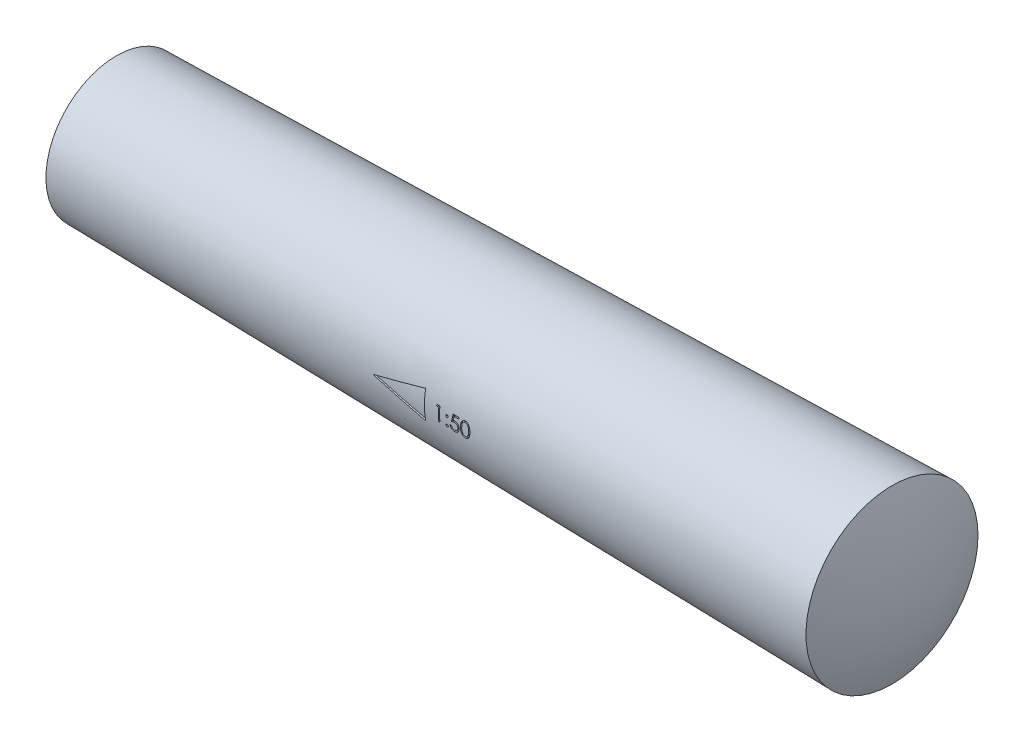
SolidWorks part; units mm, degrees
ref_plane "Front Plane" through (0, 0, 0) normal (0, 0, 1) x (1, 0, 0)
ref_plane "Top Plane" through (0, 0, 0) normal (0, 1, 0) x (1, 0, 0)
ref_plane "Right Plane" through (0, 0, 0) normal (1, 0, 0) x (0, 0, -1)
sketch "Sketch1" plane through (0, 0, 0) normal (1, 0, 0) x (0, 0, -1)
  circle A0 centre (0, 0) radius 5
  dimension "D1" = 10
extrude "Extrude1" add sketch "Sketch1" along normal mid plane 55
draft "Draft1" type of draft neutral plane draft angle 1.146 faces to draft 1 parameters "D1"=1.146
sketch "Sketch2" plane through (0, 0, 0) normal (0, 0, 1) x (1, 0, 0)
  line L0 (-27.5, 0) -> (-27.5, 5)
  line L1 (-27.5, 5) -> (-27.5, -5) construction
  line L2 (-27.5, 0) -> (-28.7, 0)
  line L3 (-28.7, 0) -> (-28.7, -5.55) construction
  line L4 (27.5, 0) -> (27.5, 6.1)
  line L5 (27.5, -6.1) -> (27.5, 6.1) construction
  line L6 (27.5, 0) -> (28.7, 0)
  line L7 (28.7, 0) -> (28.7, -5.55) construction
  line L8 (-27.5, -5) -> (27.5, -6.1) construction
  arc A0 (-28.7, 0) -> (-27.5, 5) centre (-17.6833, 0) cw
  arc A1 (28.7, 0) -> (27.5, 6.1) centre (12.5957, 0) ccw
  point P14 (0, -5.55)
revolve "Revolve1" add sketch "Sketch2" angle 360 about L2
sketch "Sketch5" plane through (0, 0, 0) normal (0, 0, 1) x (1, 0, 0)
  line L0 (0, 5.55) -> (0, -5.55) construction
  line L1 (27.5, 6.1) -> (-27.5, 5) construction
  line L2 (-27.5, -5) -> (27.5, -6.1) construction
ref_plane "Plane2" through (0, 0, 0) normal (-0.02, 0, 0.9998) x (0.9998, 0, 0.02)
sketch "Sketch6" plane through (0, 0, 0) normal (-0.02, 0, 0.9998) x (0.9998, 0, 0.02)
  line L0 (0, 0) -> (0, 1)
  line L1 (0, 5.55) -> (0, -5.55) construction
  line L2 (0, 1) -> (-3.7321, 0)
  line L3 (-3.7321, 0) -> (0, -1)
  line L4 (0, -1) -> (0, 0)
  line L5 (0, -0.5) -> (4, -0.5) construction
  text T0 "1:50" font "Century Gothic" height 1
  dimension "D1" = 2
  dimension "D2" = 30
  dimension "D3" = 4
wrap "Wrap2" sketch "Sketch6" wrap type deboss source sketch "Sketch6" thickness 0.1 parameters "D1"=0.1
equation "\"D2@Sketch2\" = \"D1@Sketch2\""
